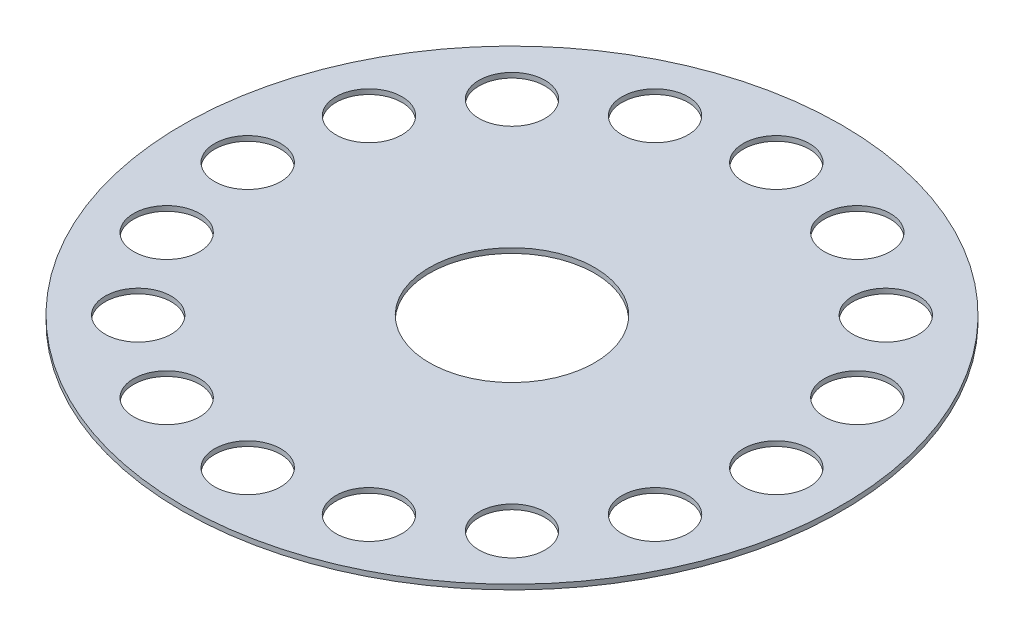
SolidWorks part; units mm, degrees
ref_plane "Front Plane" through (0, 0, 0) normal (0, 0, 1) x (1, 0, 0)
ref_plane "Top Plane" through (0, 0, 0) normal (0, 1, 0) x (1, 0, 0)
ref_plane "Right Plane" through (0, 0, 0) normal (1, 0, 0) x (0, 0, -1)
sketch "Sketch1" plane through (0, 0, 0) normal (0, 1, 0) x (1, 0, 0)
  circle A0 centre (0, 0) radius 99.75
  dimension "D1" = 199.5
extrude "Boss-Extrude1" add sketch "Sketch1" along normal blind 1.5
sketch "Sketch2" plane through (0, 1.5, 0) normal (0, 1, 0) x (1, 0, 0)
  line L0 (0, 80) -> (0, 0) construction
  circle A0 centre (0, 80) radius 10
  dimension "D1" = 20
  dimension "D2" = 80
extrude "Cut-Extrude1" cut sketch "Sketch2" against normal through all
pattern_circular "CirPattern1" count 16 over 360 about axis through (0, 0, 0) along (0, 1, 0) of "Cut-Extrude1"
sketch "Sketch4" plane through (0, 0, 0) normal (0, -1, 0) x (-1, 0, 0)
  circle A0 centre (0, 0) radius 25
  circle A1 centre (0, 0) radius 99.75 construction
  dimension "D1" = 50
extrude "Cut-Extrude3" cut sketch "Sketch4" against normal through all
